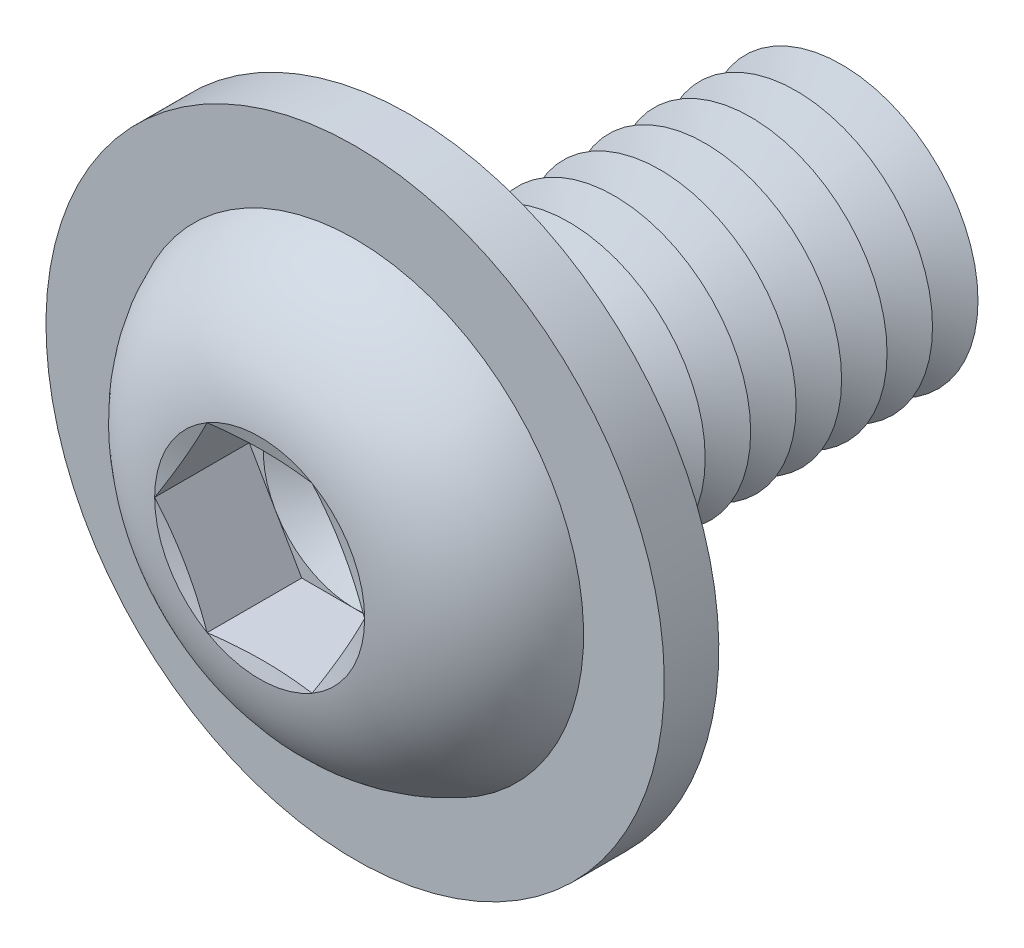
SolidWorks part; units mm, degrees
ref_plane "Front Plane" through (0, 0, 0) normal (0, 0, 1) x (1, 0, 0)
ref_plane "Top Plane" through (0, 0, 0) normal (0, 1, 0) x (1, 0, 0)
ref_plane "Right Plane" through (0, 0, 0) normal (1, 0, 0) x (0, 0, -1)
sketch "Sketch1" plane through (0, 0, 0) normal (1, 0, 0) x (0, 0, -1)
  line L0 (0, 3) -> (0, 5.25)
  line L3 (0, 3) -> (10, 3)
  line L4 (10, 3) -> (10, 0)
  line L5 (10, 0) -> (-3.3, 0) construction
  line L6 (-3.3, 0) -> (10, 0)
  line L7 (-3.3, 2.3094) -> (-3.3, 1.1547) construction
  line L8 (-3.3, 1.1547) -> (-3.3, 0)
  line L9 (-3.3, 2.3094) -> (-2.9906, 1.1547)
  line L10 (-2.9906, 1.1547) -> (-3.3, 1.1547)
  line L11 (10, 0) -> (22.7481, 0) construction
  line L12 (0, 5.25) -> (-3.3, 5.25) construction
  arc A1 (0, 5.25) -> (-3.3, 2.3094) centre (0, 1.928) ccw
  point P8 (10, 1.5)
  dimension "D1" = 10.5
  dimension "D2" = 6
  dimension "D3" = 3.3
  dimension "D4" = 4.6188
  dimension "D5" = 10
  dimension "D6" = 15
revolve "Revolve1" add sketch "Sketch1" angle 360 about L5
fillet "Fillet1" radius 0.5 1 edges at (-3, 0, 0)
sketch "Sketch2" plane through (0, 0, 0) normal (1, 0, 0) x (0, 0, -1)
  line L0 (9.5, 3) -> (10.5, 3)
  line L1 (10, 3) -> (0.5, 3) construction
  line L2 (10.5, 3) -> (10, 2.134)
  line L3 (10, -3) -> (10, 3) construction
  line L4 (10, 2.134) -> (9.5, 3)
  dimension "D1" = 1
revolve "Cut-Revolve1" cut sketch "Sketch2" angle 360 about axis through (0, 0, -10) along (0, 0, -1)
pattern_linear "LPattern1" count 10 spacing 1 along (0, 0, 1) of "Cut-Revolve1"
sketch "Sketch3" plane through (0, 0, 3.3) normal (0, 0, 1) x (1, 0, 0)
  line L7 (1.1547, 2) -> (-1.1547, 2)
  line L8 (-1.1547, 2) -> (-2.3094, 0)
  line L9 (-2.3094, 0) -> (-1.1547, -2)
  line L10 (-1.1547, -2) -> (1.1547, -2)
  line L11 (1.1547, -2) -> (2.3094, 0)
  line L12 (2.3094, 0) -> (1.1547, 2)
  circle A0 centre (0, 0) radius 2 construction
  circle A3 centre (0, 0) radius 2.3094 construction
extrude "Cut-Extrude1" cut sketch "Sketch3" against normal blind 2.08
sketch "Sketch4" plane through (0, 0, 1.22) normal (0, 0, 1) x (1, 0, 0)
  line L1 (1.1547, 2) -> (-1.1547, 2) construction
  circle A0 centre (0, 0) radius 2
extrude "Cut-Extrude2" cut sketch "Sketch4" against normal through all draft 60
sketch "Sketch5" plane through (0, 0, 0) normal (0, 0, -1) x (-1, 0, 0)
  circle A0 centre (0, 0) radius 6.8
  circle A1 centre (0, 0) radius 3.5
  circle A2 centre (0, 0) radius 3.5 construction
  dimension "D1" = 13.6
extrude "Boss-Extrude1" add sketch "Sketch5" against normal blind 1.2
